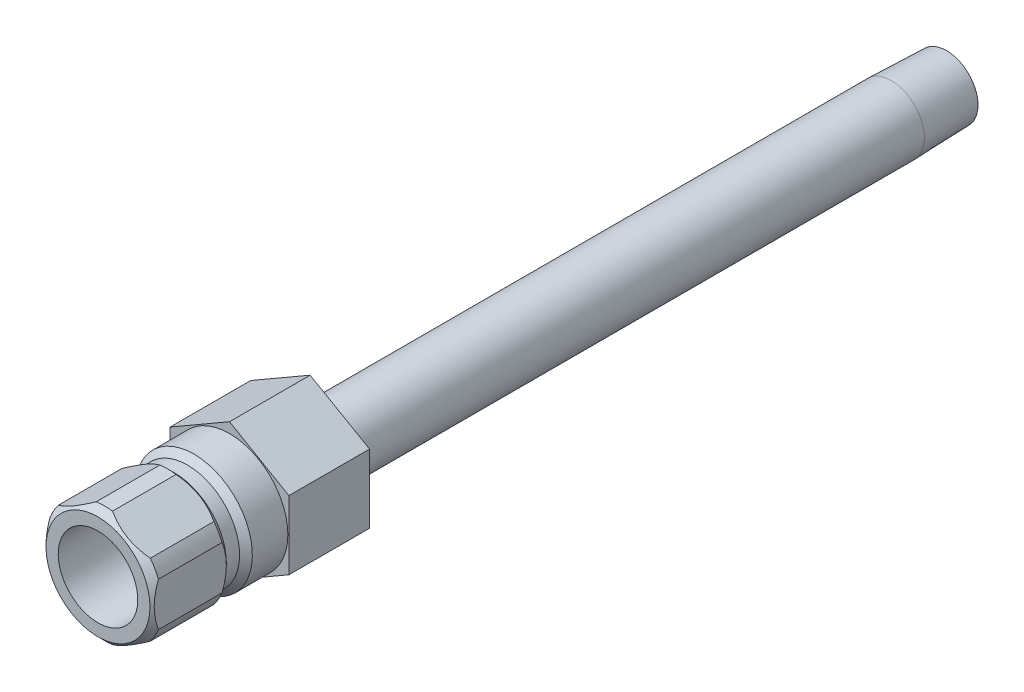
SolidWorks part; units mm, degrees
ref_plane "Front Plane" through (0, 0, 0) normal (0, 0, 1) x (1, 0, 0)
ref_plane "Top Plane" through (0, 0, 0) normal (0, 1, 0) x (1, 0, 0)
ref_plane "Right Plane" through (0, 0, 0) normal (1, 0, 0) x (0, 0, -1)
sketch "Sketch1" plane through (0, 0, 0) normal (1, 0, 0) x (0, 0, -1)
  line L0 (9.652, 0) -> (-18.923, 0) construction
  line L1 (-15.748, 4.7625) -> (-15.748, 6.223)
  line L2 (-6.604, 6.223) -> (-6.604, 0) construction
  line L3 (-14.986, 6.985) -> (-7.366, 6.985)
  line L4 (-3.556, 4.7625) -> (-2.4351, 2.6543)
  line L5 (-6.604, 6.223) -> (-5.0165, 6.223)
  line L6 (-4.2545, 6.985) -> (9.652, 6.985)
  line L7 (9.652, 6.985) -> (9.652, 3.9688)
  line L8 (-6.604, 6.223) -> (-7.366, 6.985)
  line L9 (-5.0165, 6.223) -> (-4.2545, 6.985)
  line L10 (-15.748, 6.223) -> (-14.986, 6.985)
  line L12 (9.652, 3.9688) -> (79.2226, 3.9688)
  line L13 (79.2226, 3.9688) -> (85.852, 3.7616)
  line L14 (85.852, 3.7616) -> (85.852, 2.6543)
  line L16 (9.652, 6.731) -> (9.652, 0) construction
  line L19 (-3.556, 4.7625) -> (-15.748, 4.7625)
  line L20 (-2.4351, 2.6543) -> (85.852, 2.6543)
  dimension "D2" = 1.5875
  dimension "D3" = 0.762
  dimension "D4" = 45
  dimension "D5" = 9.144
  dimension "D6" = 45
  dimension "D7" = 1.79
  dimension "D8" = 6.6294
  dimension "D9" = 101.6
  dimension "D10" = 3.175
  dimension "D11" = 9.525
  dimension "D12" = 7.9375
  dimension "D13" = 25.4
  dimension "D14" = 13.97
  dimension "D15" = 5.3086
  dimension "D16" = 118
  dimension "D17" = 12.192
  dimension "D18" = 15.748
revolve "Revolve1" add sketch "Sketch1" angle 360 about L0
sketch "Sketch2" plane through (0, 0, 0) normal (0, 0, 1) x (1, 0, 0)
  line L1 (-7.112, 4.1061) -> (-7.112, -4.1061)
  line L2 (-7.112, -4.1061) -> (0, -8.2122)
  line L3 (0, -8.2122) -> (7.112, -4.1061)
  line L4 (7.112, -4.1061) -> (7.112, 4.1061)
  line L5 (7.112, 4.1061) -> (0, 8.2122)
  line L6 (0, 8.2122) -> (-7.112, 4.1061)
  circle A0 centre (0, 0) radius 7.112 construction
  circle A2 centre (0, 0) radius 2.6543
  circle A3 centre (0, 0) radius 2.6543 construction
  dimension "D1" = 14.224
extrude "Boss-Extrude1" add sketch "Sketch2" against normal up to vertex (9.652 mm away)
sketch "Sketch3" plane through (0, 0, 0) normal (0, 0, 1) x (1, 0, 0)
  line L1 (6.477, 3.7395) -> (0, 7.479)
  line L2 (0, 7.479) -> (-6.477, 3.7395)
  line L3 (-6.477, 3.7395) -> (-6.477, -3.7395)
  line L4 (-6.477, -3.7395) -> (0, -7.479)
  line L5 (0, -7.479) -> (6.477, -3.7395)
  line L6 (6.477, -3.7395) -> (6.477, 3.7395)
  circle A0 centre (0, 0) radius 6.477 construction
  dimension "D1" = 12.954
extrude "Cut-Extrude1" cut sketch "Sketch3" along normal through all from vertex at 6.604 flip side to cut
